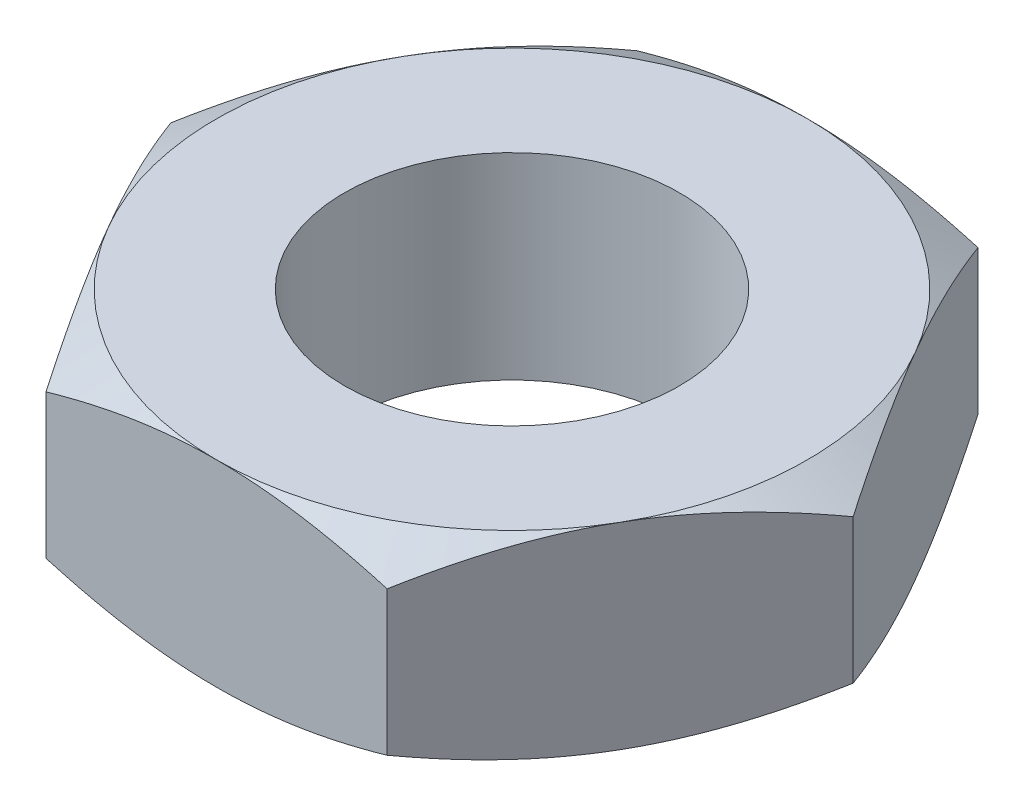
SolidWorks part; units mm, degrees
ref_plane "Front" through (0, 0, 0) normal (0, 0, 1) x (1, 0, 0)
ref_plane "Top" through (0, 0, 0) normal (0, 1, 0) x (1, 0, 0)
ref_plane "Right" through (0, 0, 0) normal (1, 0, 0) x (0, 0, -1)
sketch "Sketch1" plane through (0, 0, 0) normal (0, 1, 0) x (1, 0, 0)
  line L1 (10.3923, 0) -> (5.1962, 9)
  line L2 (5.1962, 9) -> (-5.1962, 9)
  line L3 (-5.1962, 9) -> (-10.3923, 0)
  line L4 (-10.3923, 0) -> (-5.1962, -9)
  line L5 (-5.1962, -9) -> (5.1962, -9)
  line L6 (5.1962, -9) -> (10.3923, 0)
  circle A0 centre (0, 0) radius 9 construction
  dimension "D1" = 18
extrude "Extrude1" add sketch "Sketch1" along normal mid plane 6
hole_wizard "M12x1.75 Tapped Hole1" positions "Sketch2" profile "Sketch3" tap size "M12x1.75" standard "ANSI Metric"
sketch "Sketch2" plane through (0, 3, 0) normal (0, 1, 0) x (1, 0, 0)
  point P0 (0, 0)
sketch "Sketch3" plane through (0, 3, 0) normal (1, 0, 0) x (0, 0, 1)
  line L0 (0, 0) -> (0, 6)
  line L1 (0, 6) -> (5.1, 6)
  line L2 (5.1, 6) -> (5.1, 0)
  line L5 (5.1, 0) -> (0, 0)
  line L11 (0, -6.35) -> (0, 107.95) construction
  dimension "Thru Tap Drill Dia." = 10.2
  dimension "Thru Tap Drill Depth" = 6
sketch "Sketch4" plane through (0, 3, 0) normal (0, 1, 0) x (1, 0, 0)
  line L0 (10.3923, 0) -> (5.1962, 9) construction
  circle A0 centre (0, 0) radius 9
extrude "Cut-Extrude1" cut sketch "Sketch4" against normal through all draft 60 flip side to cut
mirror "Mirror1" about plane through (0, 0, 0) normal (0, 1, 0) of "Cut-Extrude1"
